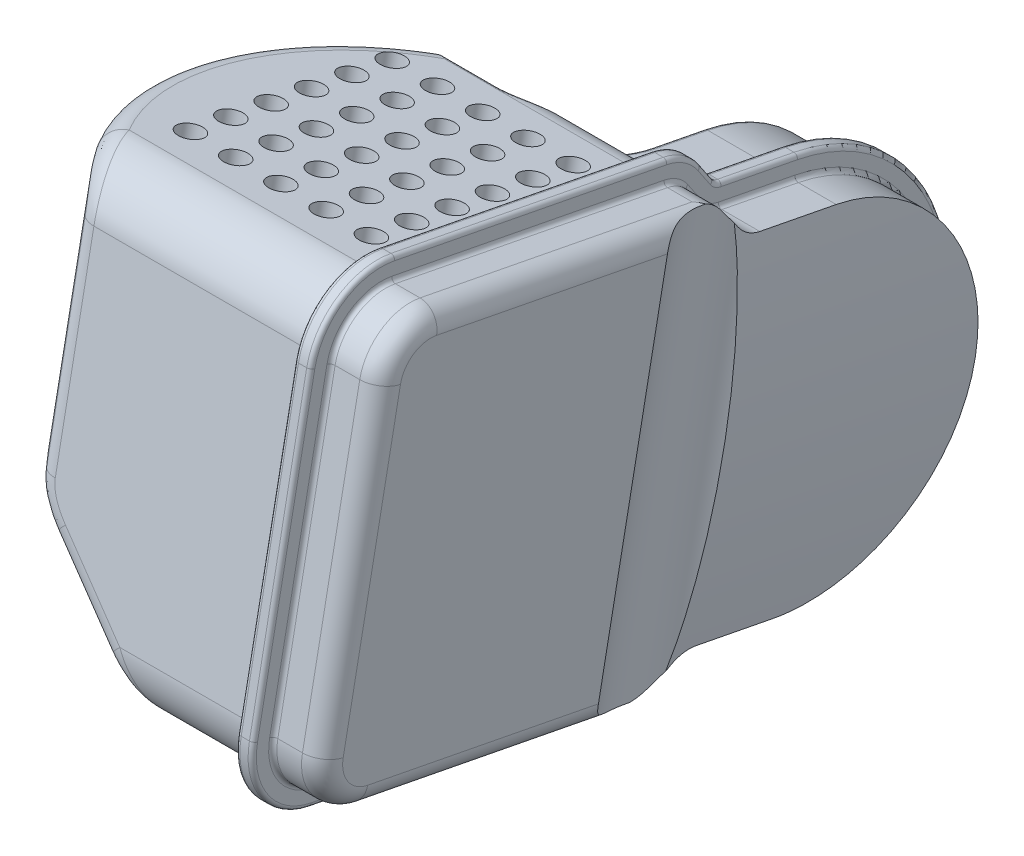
SolidWorks part; units mm, degrees
ref_plane "Front" through (0, 0, 0) normal (0, 0, 1) x (1, 0, 0)
ref_plane "Top" through (0, 0, 0) normal (0, 1, 0) x (1, 0, 0)
ref_plane "Right" through (0, 0, 0) normal (1, 0, 0) x (0, 0, -1)
imported_body "Imported1"
sketch "Sketch1" plane through (0, -137.1372, 26.6568) normal (0, 0.9816, -0.1908) x (-1, 0, 0)
  line L0 (711.8688, -354.3502) -> (725.8388, -354.3502) construction
  line L1 (711.8688, -354.3502) -> (711.8688, -367.0502) construction
  circle A0 centre (711.8688, -354.3502) radius 3.81
  circle A1 centre (725.8388, -354.3502) radius 3.81
  circle A2 centre (739.8088, -354.3502) radius 3.81
  circle A3 centre (753.7788, -354.3502) radius 3.81
  circle A4 centre (767.7488, -354.3502) radius 3.81
  circle A5 centre (711.8688, -367.0502) radius 3.81
  circle A6 centre (725.8388, -367.0502) radius 3.81
  circle A7 centre (739.8088, -367.0502) radius 3.81
  circle A8 centre (753.7788, -367.0502) radius 3.81
  circle A9 centre (767.7488, -367.0502) radius 3.81
  circle A10 centre (711.8688, -379.7502) radius 3.81
  circle A11 centre (725.8388, -379.7502) radius 3.81
  circle A12 centre (739.8088, -379.7502) radius 3.81
  circle A13 centre (753.7788, -379.7502) radius 3.81
  circle A14 centre (767.7488, -379.7502) radius 3.81
  circle A15 centre (711.8688, -392.4502) radius 3.81
  circle A16 centre (725.8388, -392.4502) radius 3.81
  circle A17 centre (739.8088, -392.4502) radius 3.81
  circle A18 centre (753.7788, -392.4502) radius 3.81
  circle A19 centre (767.7488, -392.4502) radius 3.81
  circle A20 centre (711.8688, -405.1502) radius 3.81
  circle A21 centre (725.8388, -405.1502) radius 3.81
  circle A22 centre (739.8088, -405.1502) radius 3.81
  circle A23 centre (753.7788, -405.1502) radius 3.81
  circle A24 centre (767.7488, -405.1502) radius 3.81
  circle A25 centre (711.8688, -417.8502) radius 3.81
  circle A26 centre (725.8388, -417.8502) radius 3.81
  circle A27 centre (739.8088, -417.8502) radius 3.81
  circle A28 centre (753.7788, -417.8502) radius 3.81
  circle A29 centre (767.7488, -417.8502) radius 3.81
  dimension "D1" = 90
  dimension "D2" = 7.62
extrude "Cut-Extrude1" cut sketch "Sketch1" against normal blind 25.4
